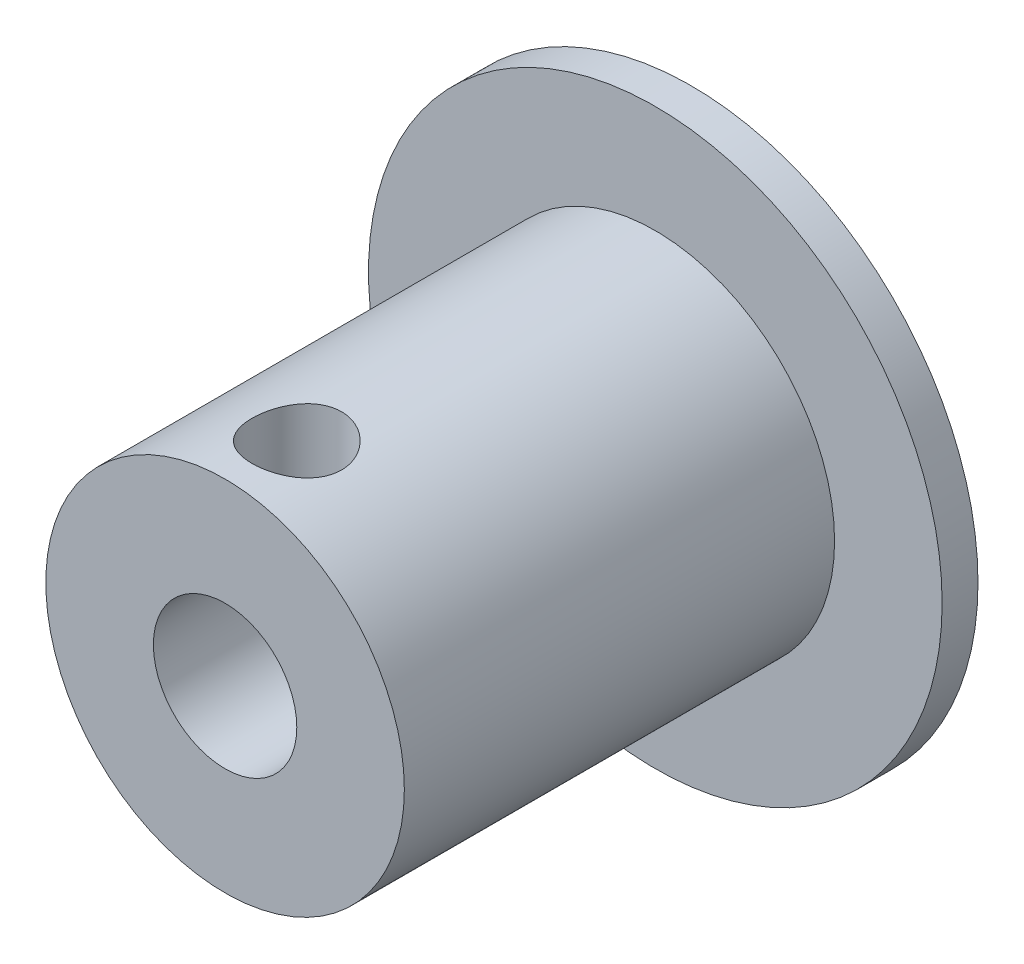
SolidWorks part; units mm, degrees
ref_plane "Front" through (0, 0, 0) normal (0, 0, 1) x (1, 0, 0)
ref_plane "Top" through (0, 0, 0) normal (0, 1, 0) x (1, 0, 0)
ref_plane "Right" through (0, 0, 0) normal (1, 0, 0) x (0, 0, -1)
sketch "Esquisse1" plane through (0, 0, 0) normal (0, 0, 1) x (1, 0, 0)
  circle A0 centre (0, 0) radius 8
  dimension "D1" = 16
extrude "Boss.-Extru.1" add sketch "Esquisse1" along normal blind 1
sketch "Esquisse2" plane through (0, 0, 1) normal (0, 0, 1) x (1, 0, 0)
  circle A0 centre (0, 0) radius 5
  dimension "D1" = 10
extrude "Boss.-Extru.2" add sketch "Esquisse2" along normal blind 12
hole_wizard "Diamètre du perçage Ø0.15 (0.15)1" positions "Esquisse4" profile "Esquisse3" hole size "Ø0.15" standard "Ansi Metric"
sketch "Esquisse4" plane through (0, 0, 0) normal (0, 0, -1) x (-1, 0, 0)
  point P0 (0, 0)
sketch "Esquisse3" plane through (0, 0, 0) normal (1, 0, 0) x (0, 1, 0)
  line L0 (0, 0) -> (0, 13)
  line L1 (0, 13) -> (2, 13)
  line L2 (2, 13) -> (2, 0)
  line L5 (2, 0) -> (0, 0)
  line L11 (0, -6.35) -> (0, 107.95) construction
  dimension "Diamètre du perçage jusqu'au prochain" = 4
  dimension "Profondeur du perçage jusqu'au prochain" = 13
ref_plane "Plan1" through (0, 5, 0) normal (0, 1, 0) x (1, 0, 0)
hole_wizard "Trou taraudé M31" positions "Esquisse6" profile "Esquisse5" tap size "M3" standard "ISO"
sketch "Esquisse6" plane through (0, 5, 0) normal (0, 1, 0) x (1, 0, 0)
  line L0 (-5, -13) -> (5, -13) construction
  point P0 (0, -11)
  dimension "D1" = 2
sketch "Esquisse5" plane through (0, 5, 11) normal (1, 0, 0) x (0, 0, 1)
  line L0 (0, 0) -> (0, 3)
  line L1 (0, 3) -> (1.25, 3)
  line L2 (1.25, 3) -> (1.25, 0)
  line L5 (1.25, 0) -> (0, 0)
  line L11 (0, -6.35) -> (0, 107.95) construction
  dimension "Diamètre du trou pour taraudage jusqu'au prochain" = 2.5
  dimension "Profondeur du trou pour taraudage jusqu'au prochain" = 3
